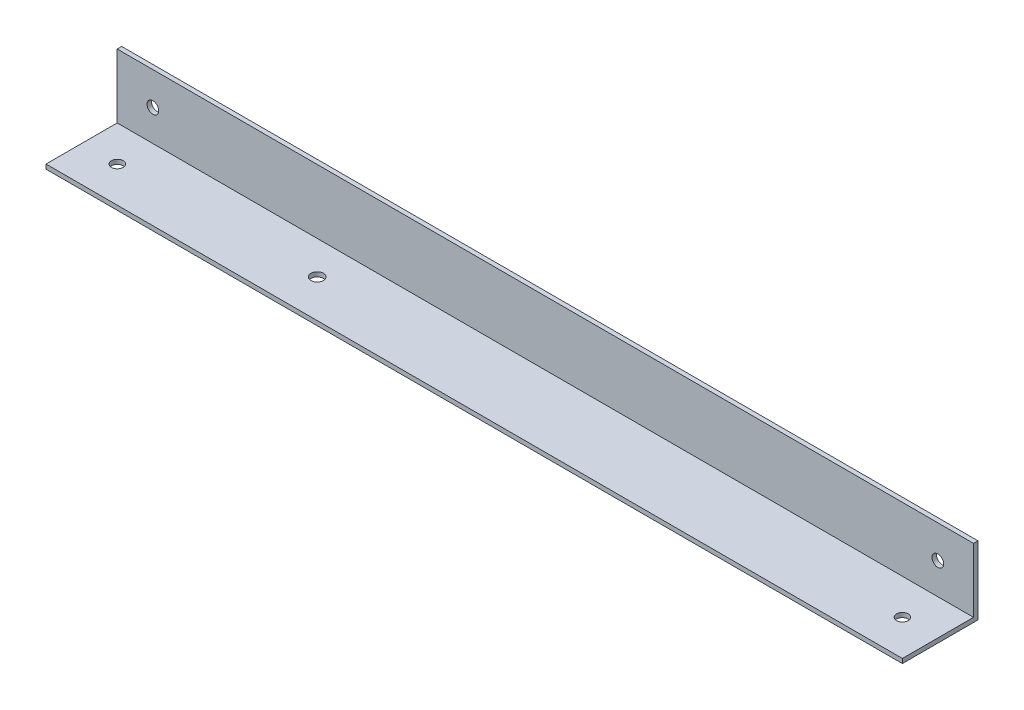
SolidWorks part; units mm, degrees
ref_plane "Front" through (0, 0, 0) normal (0, 0, 1) x (1, 0, 0)
ref_plane "Top" through (0, 0, 0) normal (0, 1, 0) x (1, 0, 0)
ref_plane "Right" through (0, 0, 0) normal (1, 0, 0) x (0, 0, -1)
sketch "Sketch1" plane through (0, 0, 0) normal (0, 0, 1) x (1, 0, 0)
  line L1 (-209.8261, 67.8385) -> (94.9739, 67.8385)
  line L2 (-209.8261, 67.8385) -> (-209.8261, 43.4545)
  line L3 (-209.8261, 43.4545) -> (94.9739, 43.4545)
  line L4 (94.9739, 67.8385) -> (94.9739, 43.4545)
  dimension "D1" = 304.8
  dimension "D2" = 24.384
extrude "Boss-Extrude1" add sketch "Sketch1" along normal blind 26.924
sketch "Sketch2" plane through (0, 67.8385, 0) normal (0, 1, 0) x (1, 0, 0)
  line L0 (-209.8261, -26.924) -> (-209.8261, 0) construction
  line L1 (-209.8261, -1.5875) -> (94.9739, -1.5875)
  line L2 (-209.8261, -1.5875) -> (-209.8261, -26.924)
  line L3 (-209.8261, -26.924) -> (94.9739, -26.924)
  line L4 (94.9739, -1.5875) -> (94.9739, -26.924)
  line L5 (94.9739, 0) -> (-209.8261, 0) construction
  dimension "D1" = 1.5875
extrude "Cut-Extrude1" cut sketch "Sketch2" against normal blind 12.7
sketch "Sketch3" plane through (0, 0, 26.924) normal (0, 0, 1) x (1, 0, 0)
  line L0 (94.9739, 43.4545) -> (94.9739, 55.1385) construction
  line L1 (-209.8261, 55.1385) -> (94.9739, 55.1385)
  line L2 (-209.8261, 55.1385) -> (-209.8261, 45.042)
  line L3 (-209.8261, 45.042) -> (94.9739, 45.042)
  line L4 (94.9739, 55.1385) -> (94.9739, 45.042)
  line L5 (-209.8261, 43.4545) -> (94.9739, 43.4545) construction
  dimension "D1" = 1.5875
extrude "Cut-Extrude3" cut sketch "Sketch3" against normal up to surface (25.3365 mm away)
sketch "Sketch4" plane through (0, 0, 0) normal (0, 0, -1) x (-1, 0, 0)
  line L0 (-94.9739, 43.4545) -> (-94.9739, 67.8385) construction
  line L1 (209.8261, 43.4545) -> (-94.9739, 43.4545) construction
  line L2 (57.4261, 28.0211) -> (57.4261, 119.205) construction
  circle A0 centre (-82.2739, 56.1545) radius 2.0828
  circle A1 centre (197.1261, 56.1545) radius 2.0828
  dimension "D3" = 4.1656
  dimension "D1" = 12.7
  dimension "D2" = 12.7
extrude "Cut-Extrude4" cut sketch "Sketch4" against normal blind 2.54
sketch "Sketch5" plane through (0, 43.4545, 0) normal (0, -1, 0) x (1, 0, 0)
  line L0 (-57.4261, 38.6497) -> (-57.4261, -24.6724) construction
  line L1 (-209.8261, 26.924) -> (-209.8261, 0) construction
  line L2 (-209.8261, 26.924) -> (94.9739, 26.924) construction
  circle A0 centre (-197.1261, 14.224) radius 2.0828
  circle A1 centre (82.2739, 14.224) radius 2.0828
  dimension "D1" = 4.1656
  dimension "D2" = 12.7
  dimension "D3" = 12.7
extrude "Cut-Extrude5" cut sketch "Sketch5" against normal blind 2.54
sketch "Sketch7" plane through (0, 43.4545, 0) normal (0, -1, 0) x (1, 0, 0)
  line L0 (-209.8261, 26.924) -> (-209.8261, 0) construction
  circle A0 centre (-126.7681, 13.462) radius 2.235
  point P4 (-209.8261, 13.462)
  dimension "D2" = 4.47
  dimension "D1" = 83.058
extrude "Cut-Extrude6" cut sketch "Sketch7" against normal blind 2.54
equation "\".5n\"=1"
